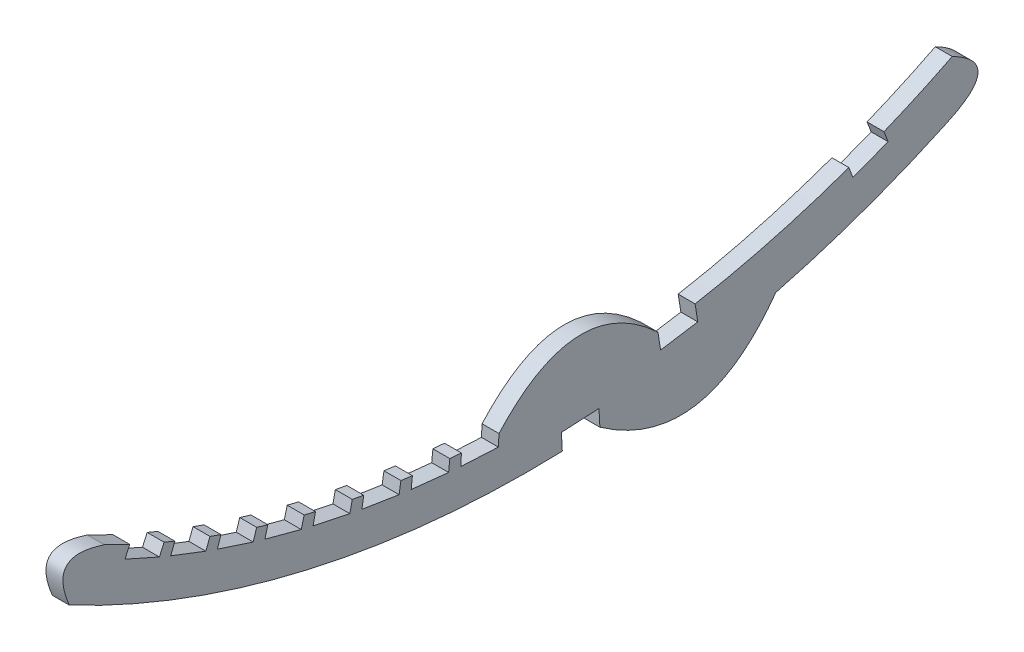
SolidWorks part; units mm, degrees
ref_plane "Front Plane" through (0, 0, 0) normal (0, 0, 1) x (1, 0, 0)
ref_plane "Top Plane" through (0, 0, 0) normal (0, 1, 0) x (1, 0, 0)
ref_plane "Right Plane" through (0, 0, 0) normal (1, 0, 0) x (0, 0, -1)
sketch "Sketch1" plane through (0, 0, 0) normal (1, 0, 0) x (0, 0, -1)
  line L0 (138.5579, -1002.6693) -> (136.6807, -990.817) construction
  line L1 (139.4965, -1008.5954) -> (159.2503, -1005.4667)
  line L2 (159.2503, -1005.4667) -> (179.0041, -1002.338)
  line L3 (159.2503, -1005.4667) -> (184.9302, -1001.3994) construction
  line L4 (133.5704, -1009.534) -> (159.2503, -1005.4667) construction
  line L5 (34.0381, -1031.6324) -> (54.0107, -1030.5857)
  line L6 (54.0107, -1030.5857) -> (73.9833, -1029.539)
  line L7 (138.5579, -1002.6693) -> (139.4965, -1008.5954)
  line L8 (178.0654, -996.4119) -> (179.0041, -1002.338)
  line L9 (-72.9366, -1009.5664) -> (-52.964, -1010.6131)
  line L10 (-52.964, -1010.6131) -> (-32.9914, -1011.6598)
  line L11 (-72.9366, -1009.5664) -> (-72.2981, -997.3831)
  line L12 (-32.9914, -1011.6598) -> (-32.3529, -999.4765)
  line L13 (178.0654, -996.4119) -> (176.1882, -984.5597) construction
  line L15 (-125.6732, -1004.3656) -> (-105.7828, -1006.4562)
  line L16 (-105.7828, -1006.4562) -> (-85.8924, -1008.5467)
  line L17 (-125.6732, -1004.3656) -> (-124.398, -992.2324)
  line L18 (-85.8924, -1008.5467) -> (-84.6171, -996.4135)
  line L21 (-178.0654, -996.4119) -> (-158.3117, -999.5406)
  line L22 (-158.3117, -999.5406) -> (-138.5579, -1002.6693)
  line L23 (-178.0654, -996.4119) -> (-176.1569, -984.3621)
  line L24 (-138.5579, -1002.6693) -> (-136.6494, -990.6195)
  line L27 (-229.9696, -985.7271) -> (-210.4066, -989.8854)
  line L28 (-210.4066, -989.8854) -> (-190.8437, -994.0436)
  line L29 (-229.9696, -985.7271) -> (-227.4331, -973.7937)
  line L30 (-190.8437, -994.0436) -> (-188.3072, -982.1102)
  line L33 (-281.2434, -972.3406) -> (-261.9249, -977.5169)
  line L34 (-261.9249, -977.5169) -> (-242.6064, -982.6933)
  line L35 (-281.2434, -972.3406) -> (-278.0858, -960.5562)
  line L36 (-242.6064, -982.6933) -> (-239.4488, -970.909)
  line L39 (-331.7463, -956.2889) -> (-312.7252, -962.4692)
  line L40 (-312.7252, -962.4692) -> (-293.7041, -968.6495)
  line L41 (-331.7463, -956.2889) -> (-327.9763, -944.6859)
  line L42 (-293.7041, -968.6495) -> (-289.9341, -957.0466)
  line L45 (-381.34, -937.616) -> (-362.6684, -944.7834)
  line L46 (-362.6684, -944.7834) -> (-343.9968, -951.9508)
  line L47 (-381.34, -937.616) -> (-376.9679, -926.2263)
  line L48 (-343.9968, -951.9508) -> (-339.6247, -940.5611)
  line L51 (-429.8884, -916.3733) -> (-411.6175, -924.508)
  line L52 (-411.6175, -924.508) -> (-393.3466, -932.6427)
  line L53 (-429.8884, -916.3733) -> (-424.9262, -905.228)
  line L54 (-393.3466, -932.6427) -> (-388.3844, -921.4975)
  line L681 (343.9968, -951.9508) -> (362.6684, -944.7834)
  line L682 (362.6684, -944.7834) -> (381.34, -937.616)
  line L683 (343.9968, -951.9508) -> (339.6247, -940.5611)
  line L684 (381.34, -937.616) -> (376.9679, -926.2263)
  line L707 (138.5579, -1002.6693) -> (136.6494, -990.6195)
  line L708 (178.0654, -996.4119) -> (176.1569, -984.3621)
  line L719 (34.9702, -1049.4175) -> (34.0381, -1031.6324)
  line L720 (74.9154, -1047.3241) -> (73.9833, -1029.539)
  line L1378 (133.5704, -1009.534) -> (129.816, -985.8295) construction
  line L1379 (129.816, -985.8295) -> (155.4959, -981.7622) construction
  line L1380 (155.4959, -981.7622) -> (181.1758, -977.6949) construction
  line L1381 (184.9302, -1001.3994) -> (181.1758, -977.6949) construction
  line L1382 (158.3117, -999.5406) -> (178.0654, -996.4119) construction
  line L1383 (138.5579, -1002.6693) -> (158.3117, -999.5406) construction
  line L1386 (136.6807, -990.817) -> (156.4345, -987.6883) construction
  line L1387 (156.4345, -987.6883) -> (176.1882, -984.5597) construction
  arc A0 (-489.1192, -929.1192) -> (34.9702, -1049.4175) centre (0, 0) ccw
  arc A1 (261.8974, -1016.8135) -> (440.3531, -953.1994) centre (0, 0) ccw
  arc A2 (-452.0119, -892.0119) -> (-424.9262, -905.228) centre (0, 0) ccw
  arc A3 (-388.3844, -921.4975) -> (-376.9679, -926.2263) centre (0, 0) ccw
  arc A4 (-339.6247, -940.5611) -> (-327.9763, -944.6859) centre (0, 0) ccw
  arc A5 (-289.9341, -957.0466) -> (-278.0858, -960.5562) centre (0, 0) ccw
  arc A6 (-239.4488, -970.909) -> (-227.4331, -973.7937) centre (0, 0) ccw
  arc A7 (-188.3072, -982.1102) -> (-176.1569, -984.3621) centre (0, 0) ccw
  arc A8 (-136.6494, -990.6195) -> (-124.398, -992.2324) centre (0, 0) ccw
  arc A9 (-84.6171, -996.4135) -> (-72.2981, -997.3831) centre (0, 0) ccw
  arc A11 (176.1569, -984.3621) -> (339.6247, -940.5611) centre (0, 0) ccw
  arc A12 (376.9679, -926.2263) -> (449.4992, -893.2807) centre (0, 0) ccw
  spline S0 degree 2 poles (-489.1192, -929.1192) (-513.2231, -871.7812) (-452.0119, -892.0119) knots 0 0 0 1 1 1
  spline S1 degree 2 poles (440.3531, -953.1994) (508.5676, -923.5084) (449.4992, -893.2807) knots 0 0 0 1 1 1
  spline S2 degree 2 poles (74.9154, -1047.3241) (184.6682, -1124.1499) (261.8974, -1016.8135) knots 0 0 0 1 1 1
  spline S3 degree 2 poles (136.6494, -990.6195) (49.3352, -909.0674) (-32.3529, -999.4765) knots 0 0 0 1 1 1
  point P17 (54.0107, -960.5562)
  point P26 (54.0107, -960.5562)
  point P29 (54.0107, -973.7937)
  point P32 (179.0041, -1072.1052)
  point P35 (179.0041, -1065.1117)
  point P38 (179.0041, -1077.6737)
  point P41 (54.0107, -951.9508)
extrude "Boss-Extrude1" add sketch "Sketch1" along normal blind 18
